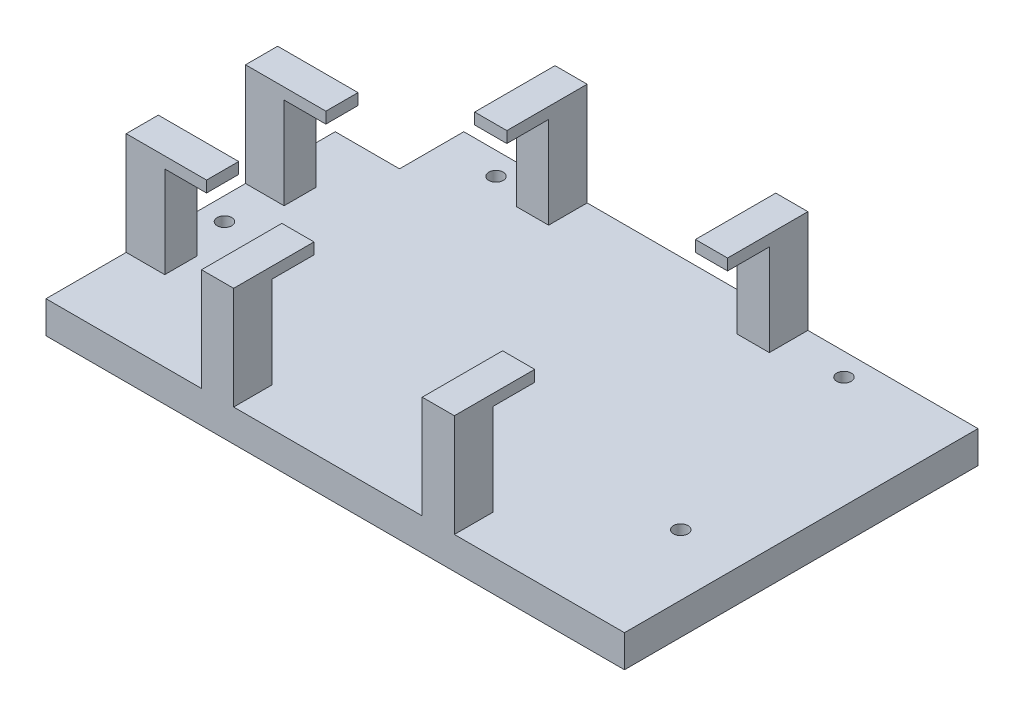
SolidWorks part; units mm, degrees
ref_plane "Front" through (0, 0, 0) normal (0, 0, 1) x (1, 0, 0)
ref_plane "Top" through (0, 0, 0) normal (0, 1, 0) x (1, 0, 0)
ref_plane "Right" through (0, 0, 0) normal (1, 0, 0) x (0, 0, -1)
sketch "Sketch1" plane through (0, 0, 0) normal (0, 1, 0) x (1, 0, 0)
  line L1 (15, 0) -> (180, 0)
  line L2 (0, -15) -> (0, -110)
  line L3 (0, -110) -> (180, -110)
  line L4 (180, 0) -> (180, -110)
  line L7 (0, -15) -> (15, -15)
  line L8 (15, 0) -> (15, -15)
  line L9 (180, -110) -> (0, -110)
  line L10 (180, -110) -> (180, 0)
  line L11 (180, 0) -> (0, 0)
  line L12 (0, -110) -> (0, 0)
  dimension "D1" = 180
  dimension "D2" = 110
  dimension "D3" = 15
  dimension "D4" = 15
extrude "Boss-Extrude1" add sketch "Sketch1" against normal blind 10 contours L12 L7 L8 L11 | L1 L8 L7 L2 L3 L4
sketch "Sketch2" plane through (0, 0, 0) normal (0, 1, 0) x (1, 0, 0)
  line L0 (180, 0) -> (0, 0) construction
  line L2 (0, 0) -> (20, 0)
  line L3 (0, 0) -> (0, -20)
  line L4 (0, -110) -> (0, 0) construction
  line L10 (0, -20) -> (20, -20)
  line L11 (20, 0) -> (20, -20)
  circle A0 centre (37.0246, -7) radius 2.25
  circle A2 centre (145.2921, -7) radius 2.25
  circle A3 centre (7, -61.4747) radius 2.25
  circle A6 centre (161, -73.5) radius 2.25
  point P3 (30.6484, -10.4568)
  point P13 (142.104, -9.5642)
  point P14 (145.2921, -10.4568)
  point P15 (37.0246, -7)
  dimension "D1" = 4.5
  dimension "D2" = 161
  dimension "D3" = 73.5
  dimension "D4" = 7
  dimension "D6" = 20
  dimension "D7" = 7
  dimension "D11" = 20
extrude "Cut-Extrude1" cut sketch "Sketch2" against normal through all
sketch "Sketch3" plane through (0, 0, 0) normal (0, 1, 0) x (1, 0, 0)
  line L1 (0, -37.9161) -> (12, -37.9161)
  line L2 (0, -37.9161) -> (0, -47.9161)
  line L3 (0, -47.9161) -> (12, -47.9161)
  line L4 (12, -37.9161) -> (12, -47.9161)
  line L6 (0, -75.0482) -> (12, -75.0482)
  line L7 (0, -75.0482) -> (0, -85.0482)
  line L8 (0, -85.0482) -> (12, -85.0482)
  line L9 (12, -75.0482) -> (12, -85.0482)
  line L10 (48.3907, 0) -> (58.3907, 0)
  line L11 (48.3907, 0) -> (48.3907, -12)
  line L12 (48.3907, -12) -> (58.3907, -12)
  line L13 (58.3907, 0) -> (58.3907, -12)
  line L15 (117.0704, 0) -> (127.0704, 0)
  line L16 (117.0704, 0) -> (117.0704, -12)
  line L17 (117.0704, -12) -> (127.0704, -12)
  line L18 (127.0704, 0) -> (127.0704, -12)
  line L19 (48.3907, -110) -> (58.3907, -110)
  line L20 (48.3907, -110) -> (48.3907, -98)
  line L21 (48.3907, -98) -> (58.3907, -98)
  line L22 (58.3907, -110) -> (58.3907, -98)
  line L24 (117.0704, -110) -> (127.0704, -110)
  line L25 (117.0704, -110) -> (117.0704, -98)
  line L26 (117.0704, -98) -> (127.0704, -98)
  line L27 (127.0704, -110) -> (127.0704, -98)
  line L29 (0, -110) -> (180, -110) construction
  line L30 (180, 0) -> (20, 0) construction
  line L31 (0, -110) -> (0, -20) construction
  dimension "D1" = 10
  dimension "D2" = 12
extrude "Boss-Extrude2" add sketch "Sketch3" along normal blind 28.5
sketch "Sketch4" plane through (0, 0, 0) normal (-1, 0, 0) x (0, 0, 1)
  line L0 (47.9161, 28.5) -> (37.9161, 28.5) construction
  line L1 (37.9161, 28.5) -> (47.9161, 28.5)
  line L2 (37.9161, 28.5) -> (37.9161, 32)
  line L3 (37.9161, 32) -> (47.9161, 32)
  line L4 (47.9161, 28.5) -> (47.9161, 32)
  line L5 (75.0482, 28.5) -> (85.0482, 28.5)
  line L6 (75.0482, 28.5) -> (75.0482, 32)
  line L7 (75.0482, 32) -> (85.0482, 32)
  line L8 (85.0482, 28.5) -> (85.0482, 32)
  dimension "D1" = 3.5
extrude "Boss-Extrude3" add sketch "Sketch4" against normal blind 25
sketch "Sketch5" plane through (0, 0, 110) normal (0, 0, 1) x (1, 0, 0)
  line L0 (48.3907, 28.5) -> (58.3907, 28.5) construction
  line L1 (48.3907, 28.5) -> (58.3907, 28.5)
  line L2 (48.3907, 28.5) -> (48.3907, 32)
  line L3 (48.3907, 32) -> (58.3907, 32)
  line L4 (58.3907, 28.5) -> (58.3907, 32)
  line L5 (117.0704, 28.5) -> (127.0704, 28.5)
  line L6 (117.0704, 28.5) -> (117.0704, 32)
  line L7 (117.0704, 32) -> (127.0704, 32)
  line L8 (127.0704, 28.5) -> (127.0704, 32)
  dimension "D1" = 3.5
  dimension "D2" = 3.5
extrude "Boss-Extrude4" add sketch "Sketch5" against normal blind 25
sketch "Sketch6" plane through (0, 0, 0) normal (0, 0, -1) x (-1, 0, 0)
  line L1 (-127.0704, 28.5) -> (-117.0704, 28.5)
  line L2 (-127.0704, 28.5) -> (-127.0704, 32)
  line L3 (-127.0704, 32) -> (-117.0704, 32)
  line L4 (-117.0704, 28.5) -> (-117.0704, 32)
  line L5 (-58.3907, 28.5) -> (-48.3907, 28.5)
  line L6 (-58.3907, 28.5) -> (-58.3907, 32)
  line L7 (-58.3907, 32) -> (-48.3907, 32)
  line L8 (-48.3907, 28.5) -> (-48.3907, 32)
  line L10 (-58.3907, 28.5) -> (-48.3907, 28.5) construction
extrude "Boss-Extrude5" add sketch "Sketch6" against normal blind 25
